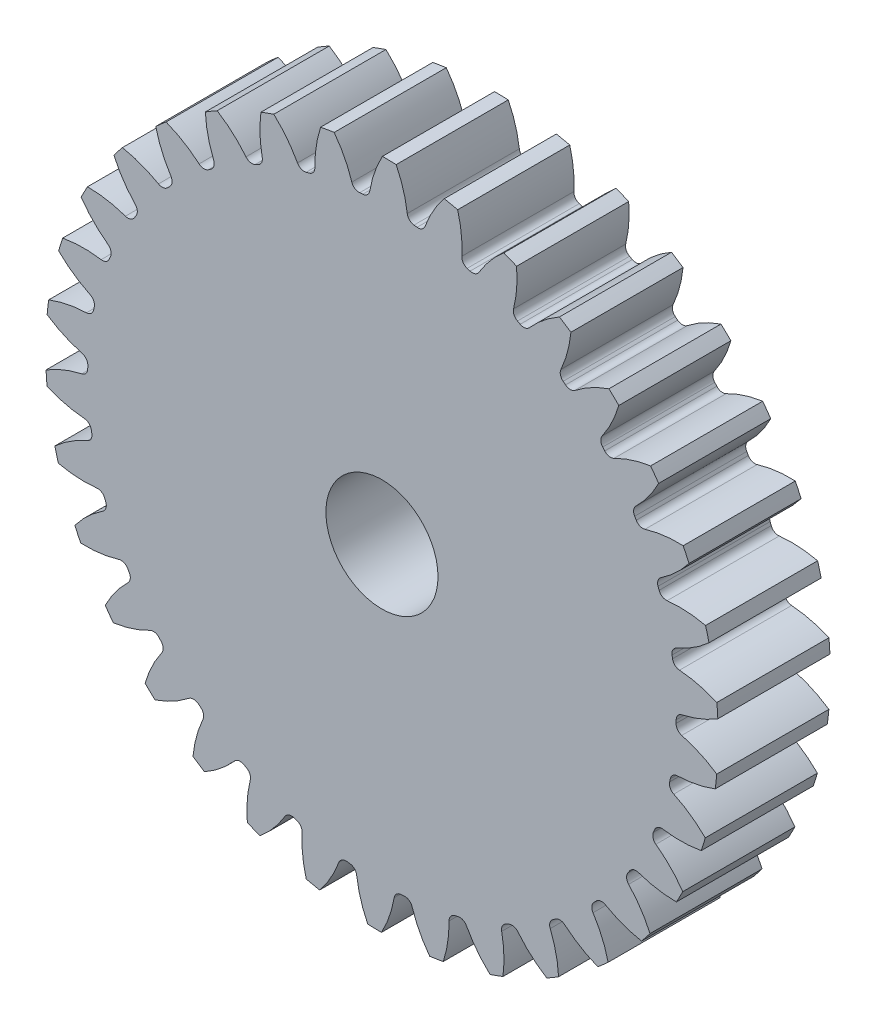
SolidWorks part; units mm, degrees
ref_plane "Front" through (0, 0, 0) normal (0, 0, 1) x (1, 0, 0)
ref_plane "Top" through (0, 0, 0) normal (0, 1, 0) x (1, 0, 0)
ref_plane "Right" through (0, 0, 0) normal (1, 0, 0) x (0, 0, -1)
sketch "Sketch3" plane through (0, 0, 0) normal (0, 0, 1) x (1, 0, 0)
  circle A0 centre (0, 0) radius 304.8
  dimension "od" = 609.6
extrude "gearBody" add sketch "Sketch3" along normal blind 101.6
sketch "Sketch2" plane through (0, 0, 0) normal (0, 0, 1) x (1, 0, 0)
  line L0 (0, 0) -> (249.9151, 103.5182) construction
  line L1 (303.8309, -28.8173) -> (0, 0) construction
  line L2 (0, 0) -> (36.3143, 0) construction
  line L3 (287.7825, 6.9599) -> (287.2034, -19.5297) construction
  line L5 (287.493, -6.2849) -> (0, 0) construction
  line L7 (0, 0) -> (270.5062, 0) construction
  arc A0 (270.4998, 1.8633) -> (270.1599, -13.6827) centre (0, 0) ccw construction
  arc A1 (304.417, 15.2743) -> (303.4587, -28.5631) centre (0, 0) ccw construction
  arc A2 (287.7825, 6.9599) -> (287.2034, -19.5297) centre (0, 0) ccw construction
  arc A3 (266.6018, -7.2358) -> (266.6633, -4.422) centre (0, 0) ccw
  arc A4 (303.8309, -28.8173) -> (271.7254, -14.0846) centre (245.1525, -114.3409) ccw
  arc A5 (303.8309, -28.8173) -> (304.8, 15.5119) centre (0, 0) ccw
  arc A6 (304.8, 15.5119) -> (272.0814, 2.1964) centre (249.9151, 103.5182) cw
  arc A7 (266.6633, -4.422) -> (272.0814, 2.1964) centre (273.5543, -4.5362) cw
  arc A8 (271.7254, -14.0846) -> (266.6018, -7.2358) centre (273.4912, -7.4228) cw
  point P6 (304.8, 15.5119)
  point P22 (303.8309, -28.8173)
  dimension "baseDia" = 541.0124
  dimension "od" = 609.6
  dimension "pd" = 575.7333
  dimension "rd" = 533.4
  dimension "rFillet" = 6.8919
  dimension "pointX" = 304.8
  dimension "pointY" = 15.5119
  dimension "CTT" = 26.4896
  dimension "flankCenterAngle" = 22.5
extrude "toothCut" cut sketch "Sketch2" along normal through all
pattern_circular "CirPattern1" count 34 over 360 about axis through (0, 0, 0) along (0, 0, 1) of "toothCut"
sketch "hub1Dia" plane through (0, 0, 0) normal (0, 0, -1) x (-1, 0, 0)
  circle A0 centre (0, 0) radius 12.7
  dimension "hub1Dia" = 25.4
sketch "hub2Dia" plane through (0, 0, 101.6) normal (0, 0, 1) x (1, 0, 0)
  circle A0 centre (0, 0) radius 12.7
  dimension "hub2dia" = 25.4
sketch "boreDia" plane through (0, 0, 0) normal (0, 0, 1) x (1, 0, 0)
  circle A0 centre (0, 0) radius 50.8
  dimension "boreDia" = 101.6
extrude "bore" cut sketch "boreDia" against normal mid plane 25400
